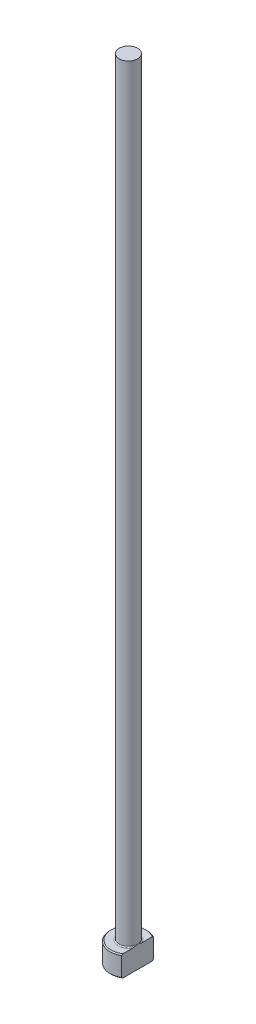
SolidWorks part; units mm, degrees
ref_plane "Front Plane" through (0, 0, 0) normal (0, 0, 1) x (1, 0, 0)
ref_plane "Top Plane" through (0, 0, 0) normal (0, 1, 0) x (1, 0, 0)
ref_plane "Right Plane" through (0, 0, 0) normal (1, 0, 0) x (0, 0, -1)
sketch "Sketch1" plane through (0, 0, 0) normal (0, 0, 1) x (1, 0, 0)
  line L0 (0, 259.9588) -> (0, -15.1925) construction
  line L1 (0, 0) -> (-3.5, 0)
  line L2 (-3.5, 0) -> (-3.5, 4)
  line L3 (-3.5, 4) -> (-1.75, 4)
  line L4 (-1.75, 4) -> (-1.75, 150)
  line L5 (-1.75, 150) -> (0, 150)
  line L6 (0, 150) -> (0, 0)
  dimension "L" = 150
  dimension "H" = 7
  dimension "T" = 4
  dimension "D" = 3.5
revolve "Revolve1" add sketch "Sketch1" angle 360 about L0
chamfer "Chamfer1" distance 0.2 angle 45 2 edges at (0, 4, 3.5) (0, 0, 3.5)
fillet "Fillet1" radius 0.2 1 edges at (0, 4, 1.75)
sketch "Sketch2" plane through (0, 0, 0) normal (0, 1, 0) x (1, 0, 0)
  line L0 (1.75, -3.0311) -> (1.75, 3.0311)
  circle A0 centre (0, 0) radius 3.5 construction
  arc A1 (1.75, -3.0311) -> (1.75, 3.0311) centre (0, 0) ccw
  circle A2 centre (0, 0) radius 1.75 construction
extrude "KEYED HEAD" cut sketch "Sketch2" along normal through all
